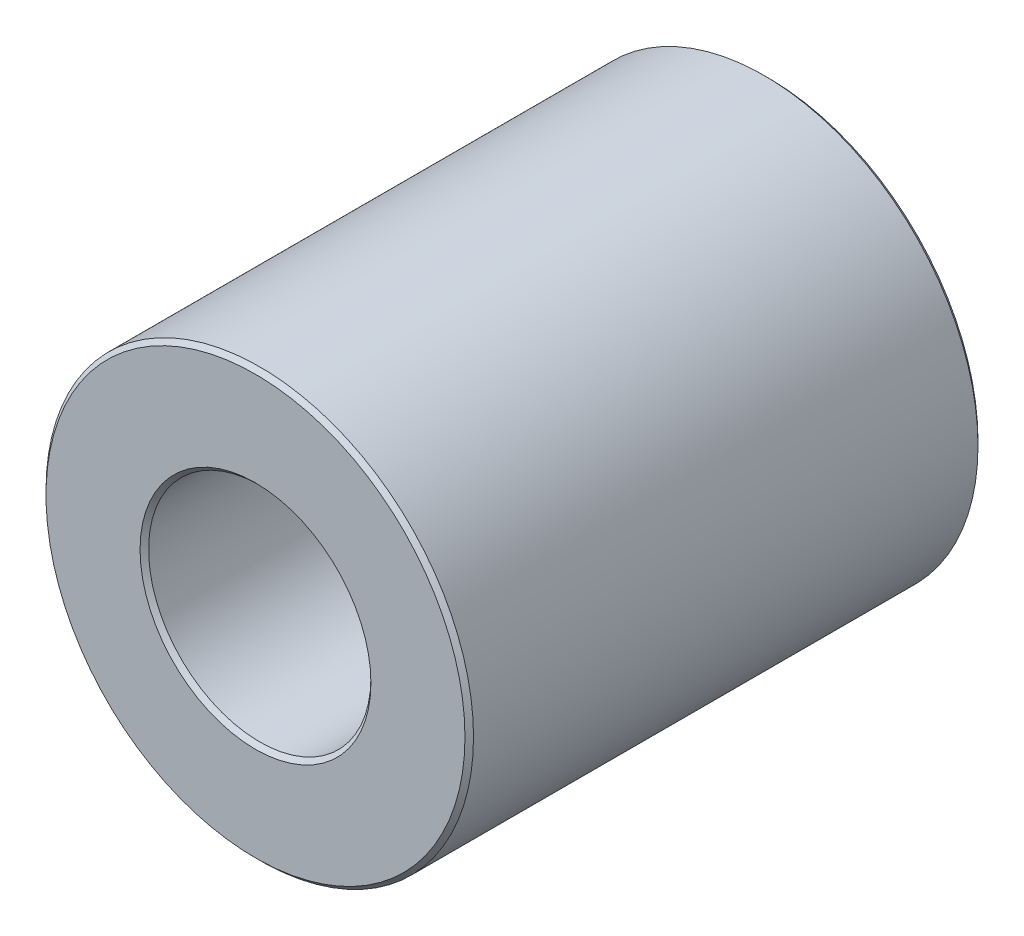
SolidWorks part; units mm, degrees
ref_plane "Front Plane" through (0, 0, 0) normal (0, 0, 1) x (1, 0, 0)
ref_plane "Top Plane" through (0, 0, 0) normal (0, 1, 0) x (1, 0, 0)
ref_plane "Right Plane" through (0, 0, 0) normal (1, 0, 0) x (0, 0, -1)
sketch "Sketch1" plane through (0, 0, 0) normal (0, 0, 1) x (1, 0, 0)
  circle A0 centre (0, 0) radius 5
  circle A1 centre (0, 0) radius 2.6
  dimension "D1" = 10
  dimension "D2" = 5.2
extrude "Boss-Extrude2" add sketch "Sketch1" along normal mid plane 12
chamfer "Chamfer3" distance 0.1 angle 45 4 edges at (5, 0, 6) (5, 0, -6) (2.6, 0, -6) (2.6, 0, 6)
